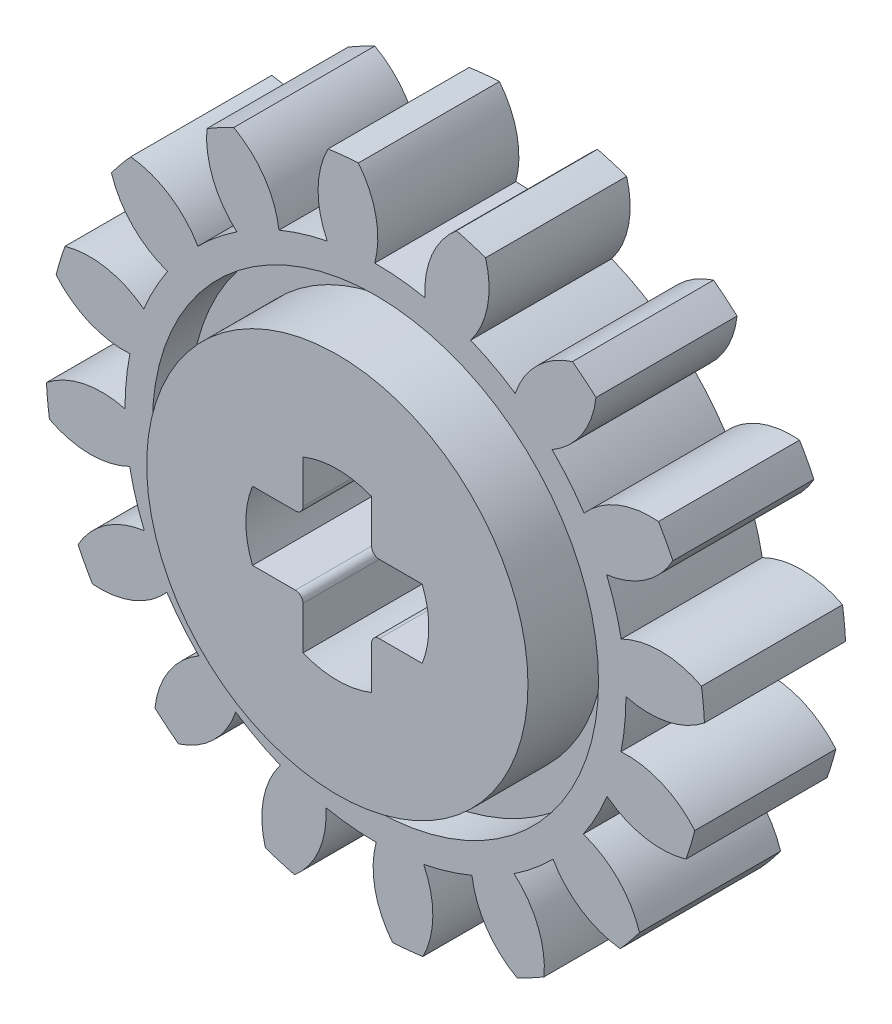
SolidWorks part; units mm, degrees
ref_plane "정면" through (0, 0, 0) normal (0, 0, 1) x (1, 0, 0)
ref_plane "윗면" through (0, 0, 0) normal (0, 1, 0) x (1, 0, 0)
ref_plane "좌측면" through (0, 0, 0) normal (1, 0, 0) x (0, 0, -1)
sketch "스케치1" plane through (0, 0, 0) normal (0, 0, 1) x (1, 0, 0)
  arc A0 (212.4071, 176.5138) -> (212.2469, 177.1571) centre (218.6934, 178.4207) cw
  arc A1 (212.2469, 177.1571) -> (210.1434, 177.177) centre (211.2148, 179.2443) cw
  arc A2 (210.1434, 177.177) -> (210.065, 177.9726) centre (218.6934, 178.4207) cw
  arc A3 (210.065, 177.9726) -> (212.1242, 178.4025) centre (211.5192, 176.154) cw
  arc A4 (212.1242, 178.4025) -> (212.254, 179.7203) centre (218.6934, 178.4207) cw
  arc A5 (212.254, 179.7203) -> (210.3183, 180.5436) centre (212.0992, 182.0435) cw
  arc A6 (210.3183, 180.5436) -> (210.5503, 181.3086) centre (218.6934, 178.4207) cw
  arc A7 (210.5503, 181.3086) -> (212.6173, 180.9178) centre (211.1978, 179.072) cw
  arc A8 (212.6173, 180.9178) -> (213.2415, 182.0856) centre (218.6934, 178.4207) cw
  arc A9 (213.2415, 182.0856) -> (211.7682, 183.5871) centre (213.9876, 184.2912) cw
  arc A10 (211.7682, 183.5871) -> (212.2753, 184.205) centre (218.6934, 178.4207) cw
  arc A11 (212.2753, 184.205) -> (214.0354, 183.0529) centre (212.0176, 181.8909) cw
  arc A12 (214.0354, 183.0529) -> (215.059, 183.893) centre (218.6934, 178.4207) cw
  arc A13 (215.059, 183.893) -> (214.2724, 185.844) centre (216.5923, 185.6452) cw
  arc A14 (214.2724, 185.844) -> (214.9774, 186.2208) centre (218.6934, 178.4207) cw
  arc A15 (214.9774, 186.2208) -> (216.1626, 184.4829) centre (213.8538, 184.1814) cw
  arc A16 (216.1626, 184.4829) -> (217.4298, 184.8673) centre (218.6934, 178.4207) cw
  arc A17 (217.4298, 184.8673) -> (217.4497, 186.9708) centre (219.5169, 185.8993) cw
  arc A18 (217.4497, 186.9708) -> (218.2452, 187.0491) centre (218.6934, 178.4207) cw
  arc A19 (218.2452, 187.0491) -> (218.6751, 184.9899) centre (216.4267, 185.595) cw
  arc A20 (218.6751, 184.9899) -> (219.9929, 184.8601) centre (218.6934, 178.4207) cw
  arc A21 (219.9929, 184.8601) -> (220.8163, 186.7959) centre (222.3162, 185.0149) cw
  arc A22 (220.8163, 186.7959) -> (221.5813, 186.5638) centre (218.6934, 178.4207) cw
  arc A23 (221.5813, 186.5638) -> (221.1904, 184.4969) centre (219.3447, 185.9163) cw
  arc A24 (221.1904, 184.4969) -> (222.3582, 183.8727) centre (218.6934, 178.4207) cw
  arc A25 (222.3582, 183.8727) -> (223.8597, 185.346) centre (224.5639, 183.1266) cw
  arc A26 (223.8597, 185.346) -> (224.4777, 184.8388) centre (218.6934, 178.4207) cw
  arc A27 (224.4777, 184.8388) -> (223.3256, 183.0788) centre (222.1635, 185.0965) cw
  arc A28 (223.3256, 183.0788) -> (224.1656, 182.0552) centre (218.6934, 178.4207) cw
  arc A29 (224.1656, 182.0552) -> (226.1166, 182.8418) centre (225.9179, 180.5218) cw
  arc A30 (226.1166, 182.8418) -> (226.4935, 182.1368) centre (218.6934, 178.4207) cw
  arc A31 (226.4935, 182.1368) -> (224.7555, 180.9515) centre (224.4541, 183.2604) cw
  arc A32 (224.7555, 180.9515) -> (225.1399, 179.6844) centre (218.6934, 178.4207) cw
  arc A33 (225.1399, 179.6844) -> (227.2434, 179.6645) centre (226.172, 177.5972) cw
  arc A34 (227.2434, 179.6645) -> (227.3218, 178.8689) centre (218.6934, 178.4207) cw
  arc A35 (227.3218, 178.8689) -> (225.2626, 178.439) centre (225.8676, 180.6875) cw
  arc A36 (225.2626, 178.439) -> (225.1328, 177.1212) centre (218.6934, 178.4207) cw
  arc A37 (225.1328, 177.1212) -> (227.0685, 176.2979) centre (225.2876, 174.798) cw
  arc A38 (227.0685, 176.2979) -> (226.8365, 175.5329) centre (218.6934, 178.4207) cw
  arc A39 (226.8365, 175.5329) -> (224.7695, 175.9237) centre (226.189, 177.7695) cw
  arc A40 (224.7695, 175.9237) -> (224.1453, 174.7559) centre (218.6934, 178.4207) cw
  arc A41 (224.1453, 174.7559) -> (225.6186, 173.2544) centre (223.3992, 172.5503) cw
  arc A42 (225.6186, 173.2544) -> (225.1115, 172.6365) centre (218.6934, 178.4207) cw
  arc A43 (225.1115, 172.6365) -> (223.3514, 173.7886) centre (225.3692, 174.9506) cw
  arc A44 (223.3514, 173.7886) -> (222.3278, 172.9485) centre (218.6934, 178.4207) cw
  arc A45 (222.3278, 172.9485) -> (223.1144, 170.9975) centre (220.7945, 171.1963) cw
  arc A46 (223.1144, 170.9975) -> (222.4094, 170.6207) centre (218.6934, 178.4207) cw
  arc A47 (222.4094, 170.6207) -> (221.2242, 172.3586) centre (223.533, 172.66) cw
  arc A48 (221.2242, 172.3586) -> (219.9571, 171.9742) centre (218.6934, 178.4207) cw
  arc A49 (219.9571, 171.9742) -> (219.9371, 169.8707) centre (217.8699, 170.9421) cw
  arc A50 (219.9371, 169.8707) -> (219.1416, 169.7924) centre (218.6934, 178.4207) cw
  arc A51 (219.1416, 169.7924) -> (218.7117, 171.8516) centre (220.9601, 171.2465) cw
  arc A52 (218.7117, 171.8516) -> (217.3939, 171.9814) centre (218.6934, 178.4207) cw
  arc A53 (217.3939, 171.9814) -> (216.5705, 170.0456) centre (215.0706, 171.8266) cw
  arc A54 (216.5705, 170.0456) -> (215.8055, 170.2777) centre (218.6934, 178.4207) cw
  arc A55 (215.8055, 170.2777) -> (216.1964, 172.3446) centre (218.0421, 170.9252) cw
  arc A56 (216.1964, 172.3446) -> (215.0286, 172.9688) centre (218.6934, 178.4207) cw
  arc A57 (215.0286, 172.9688) -> (213.5271, 171.4955) centre (212.8229, 173.7149) cw
  arc A58 (213.5271, 171.4955) -> (212.9091, 172.0026) centre (218.6934, 178.4207) cw
  arc A59 (212.9091, 172.0026) -> (214.0612, 173.7627) centre (215.2233, 171.745) cw
  arc A60 (214.0612, 173.7627) -> (213.2212, 174.7863) centre (218.6934, 178.4207) cw
  arc A61 (213.2212, 174.7863) -> (211.2702, 173.9997) centre (211.4689, 176.3197) cw
  arc A62 (211.2702, 173.9997) -> (210.8933, 174.7047) centre (218.6934, 178.4207) cw
  arc A63 (210.8933, 174.7047) -> (212.6313, 175.8899) centre (212.9327, 173.5811) cw
  arc A64 (212.6313, 175.8899) -> (212.4071, 176.5138) centre (218.6934, 178.4207) cw
extrude "베이스돌출" add sketch "스케치1" along normal mid plane 3.7
sketch "스케치2" plane through (0, 0, 1.85) normal (0, 0, 1) x (1, 0, 0)
  circle A0 centre (218.6934, 178.4207) radius 5.85
  dimension "D1" = 11.7
extrude "컷-돌출1" cut sketch "스케치2" against normal blind 1
sketch "스케치3" plane through (0, 0, -1.85) normal (0, 0, -1) x (-1, 0, 0)
  circle A0 centre (-218.6934, 178.4207) radius 5.85
  dimension "D1" = 11.7
extrude "컷-돌출2" cut sketch "스케치3" against normal blind 1
sketch "Sketch1" plane through (0, 0, -0.85) normal (0, 0, -1) x (-1, 0, 0)
  circle A0 centre (-218.6934, 178.4207) radius 5
  dimension "D1" = 10
extrude "Boss-Extrude1" add sketch "Sketch1" along normal blind 2
sketch "Sketch2" plane through (0, 0, 0.85) normal (0, 0, 1) x (1, 0, 0)
  circle A0 centre (218.6934, 178.4207) radius 5
  dimension "D1" = 10
extrude "Boss-Extrude2" add sketch "Sketch2" along normal blind 2
sketch "Sketch3" plane through (0, 0, 2.85) normal (0, 0, 1) x (1, 0, 0)
  line L0 (214.8318, 178.4207) -> (222.8591, 178.4207) construction
  line L1 (218.6934, 182.5163) -> (218.6934, 175.3653) construction
  line L2 (216.4685, 179.3207) -> (217.7934, 179.3207)
  line L3 (216.4685, 177.5207) -> (217.7934, 177.5207)
  line L4 (217.7934, 180.6456) -> (217.7934, 179.3207)
  line L5 (219.5934, 180.6456) -> (219.5934, 179.3207)
  line L6 (219.5934, 177.5207) -> (220.9183, 177.5207)
  line L7 (219.5934, 179.3207) -> (220.9183, 179.3207)
  line L8 (217.7934, 177.5207) -> (217.7934, 176.1959)
  line L9 (219.5934, 177.5207) -> (219.5934, 176.1959)
  arc A0 (216.4685, 179.3207) -> (216.4685, 177.5207) centre (218.6934, 178.4207) ccw
  arc A1 (219.5934, 180.6456) -> (217.7934, 180.6456) centre (218.6934, 178.4207) ccw
  arc A2 (220.9183, 177.5207) -> (220.9183, 179.3207) centre (218.6934, 178.4207) ccw
  arc A3 (217.7934, 176.1959) -> (219.5934, 176.1959) centre (218.6934, 178.4207) ccw
  dimension "D1" = 4.8
  dimension "D2" = 1.8
  dimension "D3" = 0.9
  dimension "D4" = 1.8
  dimension "D5" = 0.9
extrude "Cut-Extrude1" cut sketch "Sketch3" against normal through all
fillet "Fillet1" radius 0.2 4 edges at (219.5934, 177.5207, 0) (217.7934, 177.5207, 0) (219.5934, 179.3207, 0) (217.7934, 179.3207, 0)
